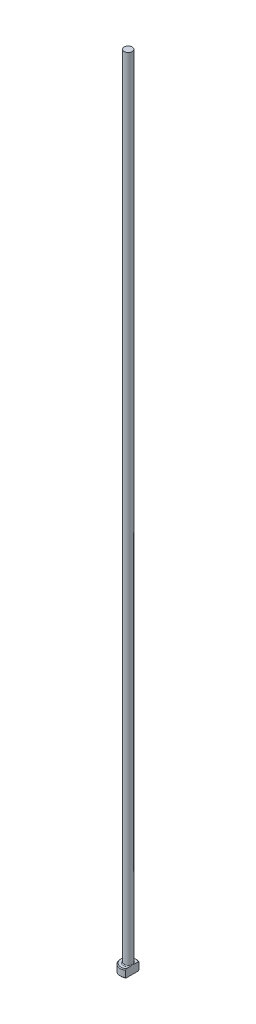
SolidWorks part; units mm, degrees
ref_plane "Front Plane" through (0, 0, 0) normal (0, 0, 1) x (1, 0, 0)
ref_plane "Top Plane" through (0, 0, 0) normal (0, 1, 0) x (1, 0, 0)
ref_plane "Right Plane" through (0, 0, 0) normal (1, 0, 0) x (0, 0, -1)
sketch "Sketch1" plane through (0, 0, 0) normal (0, 0, 1) x (1, 0, 0)
  line L0 (0, 259.9588) -> (0, -15.1925) construction
  line L1 (0, 0) -> (-2, 0)
  line L2 (-2, 0) -> (-2, 2)
  line L3 (-2, 2) -> (-1, 2)
  line L4 (-1, 2) -> (-1, 200)
  line L5 (-1, 200) -> (0, 200)
  line L6 (0, 200) -> (0, 0)
  dimension "L" = 200
  dimension "H" = 4
  dimension "T" = 2
  dimension "D" = 2
revolve "Revolve1" add sketch "Sketch1" angle 360 about L0
chamfer "Chamfer1" distance 0.2 angle 45 2 edges at (0, 2, 2) (0, 0, 2)
fillet "Fillet1" radius 0.2 1 edges at (0, 2, 1)
sketch "Sketch2" plane through (0, 0, 0) normal (0, 1, 0) x (1, 0, 0)
  line L0 (1, 1.7321) -> (1, -1.7321)
  circle A0 centre (0, 0) radius 2 construction
  arc A1 (1, -1.7321) -> (1, 1.7321) centre (0, 0) ccw
  circle A2 centre (0, 0) radius 1 construction
extrude "KEY" cut sketch "Sketch2" along normal through all
